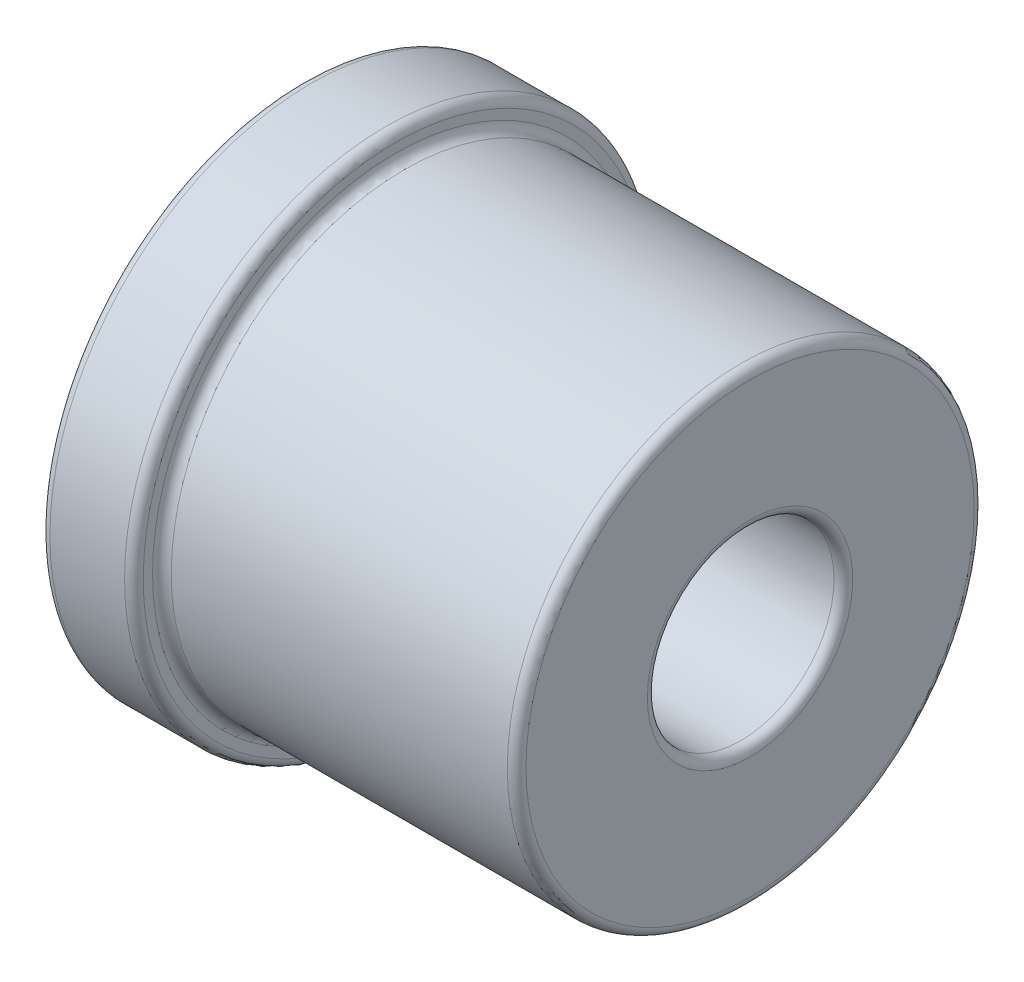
SolidWorks part; units mm, degrees
ref_plane "Plan de face" through (0, 0, 0) normal (0, 0, 1) x (1, 0, 0)
ref_plane "Plan de dessus" through (0, 0, 0) normal (0, 1, 0) x (1, 0, 0)
ref_plane "Plan de droite" through (0, 0, 0) normal (1, 0, 0) x (0, 0, -1)
sketch "Esquisse1" plane through (0, 0, 0) normal (0, 0, 1) x (1, 0, 0)
  line L0 (-25.1169, 2.8) -> (-24.1169, 2.8)
  line L1 (-24.1169, 2.8) -> (-24.1169, 2.5)
  line L2 (-24.1169, 2.5) -> (-20.3169, 2.5)
  line L3 (-20.3169, 2.5) -> (-20.3169, 0)
  line L4 (-25.1169, 2.8) -> (-25.1169, 0)
  line L5 (-25.1169, 0) -> (-20.3169, 0) construction
  line L6 (-20.3169, 0) -> (-25.1169, 0)
  dimension "D1" = 4.8
  dimension "D2" = 1
  dimension "D3" = 2.8
  dimension "D4" = 0.3
revolve "Révolution1" add sketch "Esquisse1" angle 360 about L5
sketch "Esquisse2" plane through (-20.3169, 0, 0) normal (1, 0, 0) x (0, 0, -1)
  circle A0 centre (0, 0) radius 1
  dimension "D1" = 2
extrude "Enlèv. mat.-Extru.1" cut sketch "Esquisse2" against normal through all
fillet "Congé1" radius 0.1 6 edges at (-25.1169, 0, -1) (-20.3169, 0, -1) (-25.1169, 0, 2.8) (-24.1169, 0, 2.8) (-24.1169, 0, 2.5) (-20.3169, 0, 2.5)
